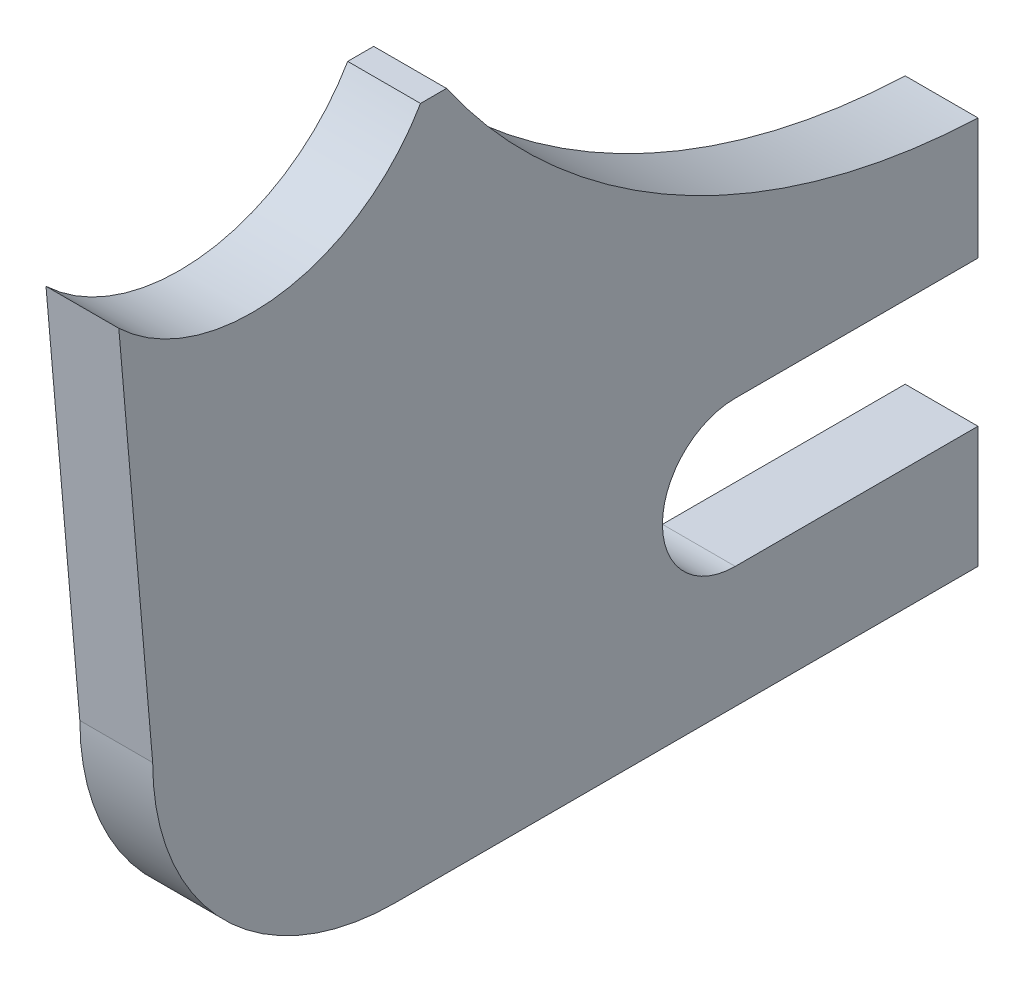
SolidWorks part; units mm, degrees
ref_plane "Front Plane" through (0, 0, 0) normal (0, 0, 1) x (1, 0, 0)
ref_plane "Top Plane" through (0, 0, 0) normal (0, 1, 0) x (1, 0, 0)
ref_plane "Right Plane" through (0, 0, 0) normal (1, 0, 0) x (0, 0, -1)
sketch "Sketch1" plane through (0, 0, 0) normal (1, 0, 0) x (0, 0, -1)
  line L0 (0, 0) -> (0, 1397) construction
  line L1 (0, 0) -> (-374.325, 1397)
  line L2 (-635, 0) -> (-723.549, 1028.0737)
  line L3 (0, -635) -> (1524, -635)
  line L4 (1524, -635) -> (1524, -317.5)
  line L5 (1524, -317.5) -> (889, -317.5)
  line L6 (889, -317.5) -> (889, -127) construction
  line L7 (889, 63.5) -> (1524, 63.5)
  line L8 (1524, 63.5) -> (1524, 381)
  line L9 (133.675, 1397) -> (133.675, 1143) construction
  line L10 (133.675, 1143) -> (65.6159, 1143)
  line L12 (-749.7137, 1331.8515) -> (-755.325, 1397)
  arc A0 (0, 635) -> (-164.3501, 613.3629) centre (0, 0) ccw
  arc A1 (-755.325, 1397) -> (-749.7137, 1331.8515) centre (-374.325, 1397) ccw
  arc A2 (889, 63.5) -> (889, -317.5) centre (889, -127) ccw
  arc A3 (-723.549, 1028.0737) -> (65.6159, 1143) centre (-374.325, 1397) ccw
  arc A4 (0, 1369.4322) -> (4.8456, 1359.7091) centre (1593.7458, 2157.6315) ccw
  arc A5 (133.675, 1143) -> (1524, 381) centre (1593.7458, 2157.6315) ccw
  arc A6 (-635, 0) -> (0, -635) centre (0, 0) ccw
  dimension "D1" = 1270
  dimension "D2" = 1397
  dimension "D3" = 15
  dimension "D4" = 1397
  dimension "D5" = 762
  dimension "D10" = 381
  dimension "D12" = 1016
  dimension "D14" = 3556
  dimension "D6" = 1524
  dimension "D7" = 317.5
  dimension "D8" = 635
  dimension "D11" = 317.5
  dimension "D13" = 254
extrude "Boss-Extrude1" add sketch "Sketch1" along normal blind 190.5
